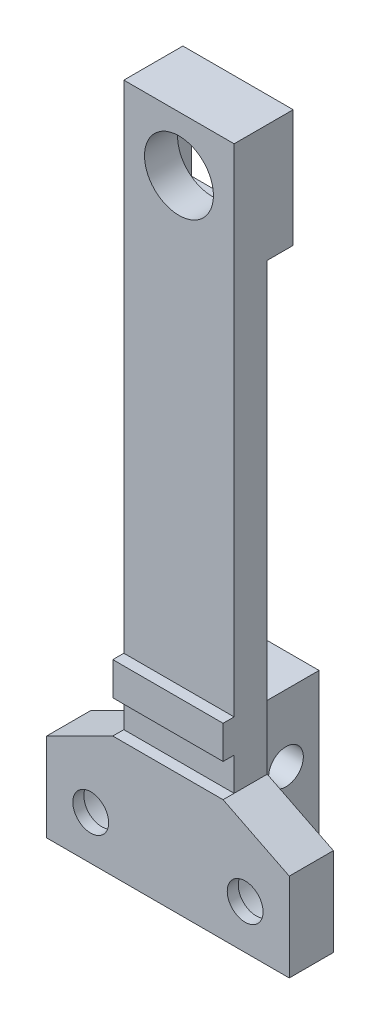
SolidWorks part; units mm, degrees
ref_plane "Front Plane" through (0, 0, 0) normal (0, 0, 1) x (1, 0, 0)
ref_plane "Top Plane" through (0, 0, 0) normal (0, 1, 0) x (1, 0, 0)
ref_plane "Right Plane" through (0, 0, 0) normal (1, 0, 0) x (0, 0, -1)
sketch "Croquis1" plane through (0, 0, 0) normal (0, 0, 1) x (1, 0, 0)
  line L1 (-5, -30) -> (5, -30)
  line L2 (-5, -30) -> (-5, 30)
  line L3 (-5, 30) -> (5, 30)
  line L4 (5, -30) -> (5, 30)
  line L5 (-5, -30) -> (5, 30) construction
  line L6 (-5, 30) -> (5, -30) construction
  point P0 (0, 0)
  dimension "D1" = 10
  dimension "D2" = 60
extrude "Saliente-Extruir1" add sketch "Croquis1" along normal blind 3
sketch "Croquis2" plane through (0, 0, 3) normal (0, 0, 1) x (1, 0, 0)
  line L0 (-5, 30) -> (-5, -30) construction
  line L1 (5, -30) -> (-5, -30)
  line L2 (5, -30) -> (5, -21)
  line L3 (5, -21) -> (-5, -21)
  line L4 (-5, -30) -> (-5, -21)
  line L5 (5, -30) -> (5, 30) construction
  line L6 (-5, -18) -> (5, -18)
  line L7 (-5, -18) -> (-5, -15)
  line L8 (-5, -15) -> (5, -15)
  line L9 (5, -18) -> (5, -15)
  dimension "D1" = 9
  dimension "D2" = 3
  dimension "D3" = 15
extrude "Saliente-Extruir2" add sketch "Croquis2" along normal blind 1
sketch "Croquis3" plane through (0, 0, 3) normal (0, 0, 1) x (1, 0, 0)
  line L0 (5, 30) -> (-5, 30) construction
  circle A0 centre (0, 25) radius 3.125
  dimension "D1" = 6.25
  dimension "D2" = 5
extrude "Cortar-Extruir1" cut sketch "Croquis3" against normal blind 3
sketch "Croquis4" plane through (0, 0, 0) normal (0, 0, -1) x (-1, 0, 0)
  line L0 (-5, -30) -> (-11, -30)
  line L1 (-11, -30) -> (-11, -24)
  line L2 (-11, -24) -> (-5, -21)
  line L3 (-5, -21) -> (-5, -30)
  line L4 (0, -30) -> (0, -15.7186) construction
  line L5 (5, -30) -> (-5, -30) construction
  line L6 (5, -21) -> (5, -30)
  line L7 (11, -24) -> (5, -21)
  line L8 (11, -30) -> (11, -24)
  line L9 (5, -30) -> (11, -30)
  dimension "D1" = 6
  dimension "D2" = 6
extrude "Saliente-Extruir3" add sketch "Croquis4" against normal blind 4
sketch "Croquis10" plane through (0, 0, 0) normal (0, 0, -1) x (-1, 0, 0)
  line L1 (-11, -30) -> (11, -30)
  line L2 (-11, -30) -> (-11, -32)
  line L3 (-11, -32) -> (11, -32)
  line L4 (11, -30) -> (11, -32)
  dimension "D1" = 2
extrude "Saliente-Extruir6" add sketch "Croquis10" against normal blind 4
sketch "Croquis5" plane through (0, 0, 0) normal (0, 0, -1) x (-1, 0, 0)
  line L0 (-11, -28) -> (11, -28) construction
  line L1 (-11, -24) -> (-11, -32) construction
  line L2 (11, -32) -> (11, -24) construction
  circle A0 centre (-7, -28) radius 3
  circle A1 centre (7, -28) radius 3
  dimension "D1" = 6
  dimension "D2" = 6
  dimension "D3" = 4
  dimension "D4" = 4
extrude "Cortar-Extruir2" cut sketch "Croquis5" against normal blind 3
sketch "Croquis7" plane through (0, 0, 3) normal (0, 0, -1) x (-1, 0, 0)
  circle A0 centre (-7, -28) radius 1.625
  circle A1 centre (7, -28) radius 1.625
  dimension "D1" = 3.25
  dimension "D2" = 3.25
extrude "Cortar-Extruir3" cut sketch "Croquis7" against normal blind 4
sketch "Croquis8" plane through (0, 0, 0) normal (0, 0, -1) x (-1, 0, 0)
  line L1 (-5, -21) -> (-5, 30) construction
  line L2 (-5, 19.343) -> (-4.1207, 19.343)
  line L3 (-4.2, 20.143) -> (-4.2, 29.2)
  line L4 (-4.2, 29.2) -> (4.2, 29.2)
  line L5 (4.2, 29.2) -> (4.2, 20.1711)
  line L6 (4.2463, 19.3711) -> (5, 19.3711)
  line L7 (5, 30) -> (5, -21) construction
  line L8 (5, 19.3711) -> (5, 30)
  line L9 (5, 30) -> (-5, 30)
  line L10 (-4.1207, 19.343) -> (-1, 19.343)
  line L11 (-1, 19.343) -> (-1, 20.143)
  line L12 (-1, 20.143) -> (-4.2, 20.143)
  line L13 (4.2463, 19.3711) -> (1, 19.3711)
  line L14 (1, 19.3711) -> (1, 20.1711)
  line L15 (1, 20.1711) -> (4.2, 20.1711)
  line L16 (-5, 30) -> (-5, 19.343)
  dimension "D1" = 0.8
  dimension "D2" = 0.8
  dimension "D3" = 0.8
  dimension "D4" = 0.8
  dimension "D5" = 4
  dimension "D6" = 4
  dimension "D7" = 0.8
extrude "Saliente-Extruir4" add sketch "Croquis8" along normal blind 15
sketch "Croquis9" plane through (0, 0, -15) normal (0, 0, -1) x (-1, 0, 0)
  line L1 (-5, 30) -> (5, 30)
  line L2 (-5, 30) -> (-5, 19.3711)
  line L3 (-5, 19.3711) -> (5, 19.3711)
  line L4 (5, 30) -> (5, 19.3711)
extrude "Saliente-Extruir5" add sketch "Croquis9" along normal blind 1
sketch "Sketch1" plane through (0, 0, 0) normal (0, 0, -1) x (-1, 0, 0)
  line L0 (20.2277, -23.5) -> (-23.0572, -23.5) construction
  line L1 (-11, -32) -> (11, -32) construction
  line L2 (-3.7009, -30.5) -> (3.7009, -30.5)
  line L3 (-3.7009, -30.5) -> (-3.7009, -16.5)
  line L4 (-3.7009, -16.5) -> (3.7009, -16.5)
  line L5 (3.7009, -30.5) -> (3.7009, -16.5)
  line L6 (-3.7009, -30.5) -> (3.7009, -16.5) construction
  line L7 (-3.7009, -16.5) -> (3.7009, -30.5) construction
  line L16 (-0.4991, -20.4) -> (2.7009, -20.4)
  line L17 (-0.4991, -20.4) -> (-0.4991, -26.6)
  line L18 (-0.4991, -26.6) -> (2.7009, -26.6)
  line L19 (2.7009, -20.4) -> (2.7009, -26.6)
  point P3 (0, -23.5)
  point P8 (0, -23.5)
  dimension "D1" = 14
  dimension "D2" = 1
  dimension "D3" = 3.2
  dimension "D4" = 6.2
  dimension "D5" = 3.1
  dimension "D6" = 7.4018
  dimension "D7" = 1.5
extrude "Boss-Extrude1" add sketch "Sketch1" along normal blind 6
sketch "Sketch2" plane through (3.7009, 0, 0) normal (1, 0, 0) x (0, 0, -1)
  line L0 (3, -16.5) -> (3, -30.5) construction
  line L1 (6, -16.5) -> (0, -16.5) construction
  line L2 (6, -30.5) -> (0, -30.5) construction
  circle A0 centre (3, -22.56) radius 1.575
  dimension "D1" = 3.15
extrude "Cut-Extrude1" cut sketch "Sketch2" against normal blind 12
sketch "Sketch3" plane through (-5, 0, 0) normal (-1, 0, 0) x (0, 0, 1)
  line L1 (-2.3547, 17.1849) -> (-16, 17.1849)
  line L2 (-2.3547, 17.1849) -> (-2.3547, 30)
  line L3 (-2.3547, 30) -> (-16, 30)
  line L4 (-16, 17.1849) -> (-16, 30)
extrude "Cut-Extrude2" cut sketch "Sketch3" against normal blind 10
